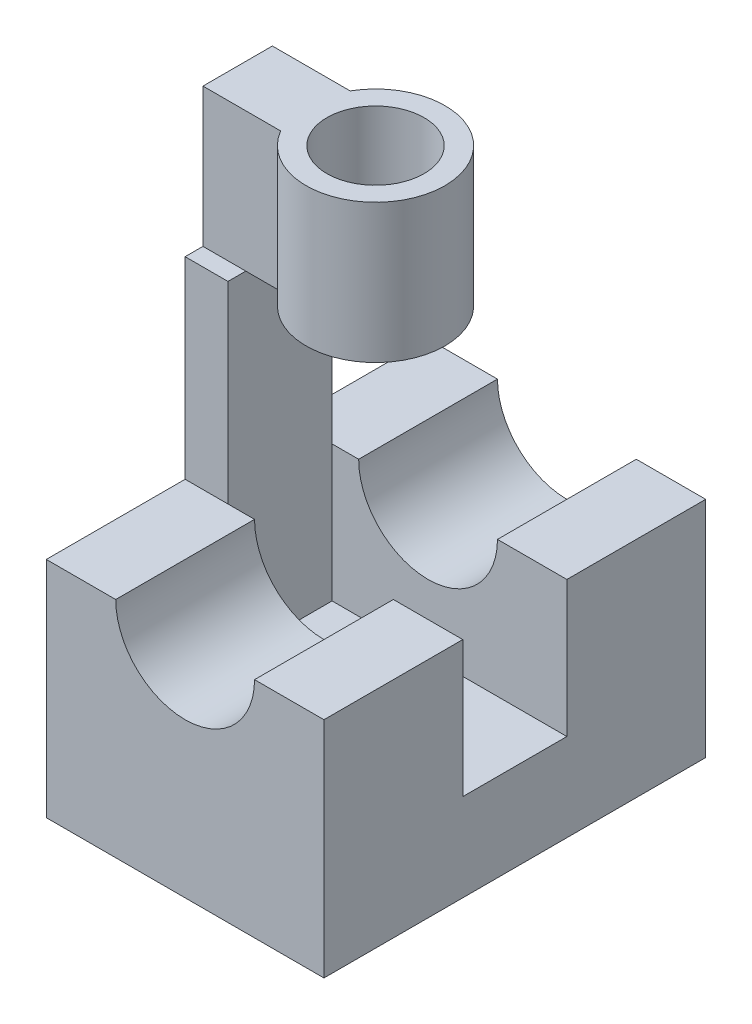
SolidWorks part; units mm, degrees
ref_plane "Plan de face" through (0, 0, 0) normal (0, 0, 1) x (1, 0, 0)
ref_plane "Plan de dessus" through (0, 0, 0) normal (0, 1, 0) x (1, 0, 0)
ref_plane "Plan de droite" through (0, 0, 0) normal (1, 0, 0) x (0, 0, -1)
sketch "Esquisse1" plane through (0, 0, 0) normal (0, 0, 1) x (1, 0, 0)
  line L0 (0, 0) -> (0, 32.2265)
  line L1 (0, 32.2265) -> (10, 32.2265)
  line L2 (30, 32.2265) -> (40, 32.2265)
  line L4 (40, 32.2265) -> (40, 0)
  line L5 (40, 0) -> (0, 0)
  arc A0 (10, 32.2265) -> (30, 32.2265) centre (20, 32.2265) ccw
  point P3 (20, 32.2265)
  dimension "D1" = 10
  dimension "D3" = 40
  dimension "D4" = 20
extrude "Boss.-Extru.1" add sketch "Esquisse1" along normal blind 55
sketch "Esquisse2" plane through (40, 0, 0) normal (1, 0, 0) x (0, 0, -1)
  line L0 (-55, 32.2265) -> (0, 32.2265) construction
  line L1 (-35, 32.2265) -> (-20, 32.2265)
  line L2 (-35, 32.2265) -> (-35, 12.6301)
  line L3 (-35, 12.6301) -> (-20, 12.6301)
  line L4 (-20, 32.2265) -> (-20, 12.6301)
  line L5 (-55, 0) -> (-55, 32.2265) construction
  line L6 (0, 0) -> (0, 32.2265) construction
  dimension "D1" = 20
  dimension "D2" = 20
extrude "Enlèv. mat.-Extru.1" cut sketch "Esquisse2" against normal blind 55
ref_plane "Plan1" through (0, 60, 0) normal (0, 1, 0) x (1, 0, 0)
sketch "Esquisse3" plane through (0, 60, 0) normal (0, 1, 0) x (1, 0, 0)
  circle A0 centre (19.8603, -27.4302) radius 7
  circle A1 centre (19.8603, -27.4302) radius 10
extrude "Boss.-Extru.2" add sketch "Esquisse3" along normal blind 20 separate body
sketch "Esquisse4" plane through (0, 60, 0) normal (0, 1, 0) x (1, 0, 0)
  line L0 (0, -22.4302) -> (11.2001, -22.4302)
  line L1 (0, -20) -> (0, 0) construction
  line L2 (11.2001, -22.4302) -> (9.8951, -28.2634)
  line L3 (11.2001, -32.4302) -> (9.8951, -28.2634)
  line L4 (11.2001, -32.4302) -> (0, -32.4302)
  line L5 (0, -55) -> (0, -35) construction
  line L6 (0, -32.4302) -> (0, -22.4302)
  circle A0 centre (19.8603, -27.4302) radius 10 construction
  circle A1 centre (19.8603, -27.4302) radius 7 construction
  point P8 (22.4633, -20.9321)
  point P12 (19.8603, -27.4302)
  dimension "D1" = 10
  dimension "D2" = 5
extrude "Boss.-Extru.3" add sketch "Esquisse4" along normal blind 20
sketch "Esquisse5" plane through (0, 60, 0) normal (0, 1, 0) x (1, 0, 0)
  line L0 (0, -35) -> (40, -35) construction
  line L1 (0, -20) -> (6.1726, -20)
  line L2 (0, -20) -> (0, -35)
  line L3 (0, -35) -> (6.1726, -35)
  line L4 (6.1726, -20) -> (6.1726, -35)
extrude "Boss.-Extru.4" add sketch "Esquisse5" against normal blind 50
sketch "Esquisse6" plane through (0, 80, 0) normal (0, 1, 0) x (1, 0, 0)
  point P0 (19.8603, -27.4302)
